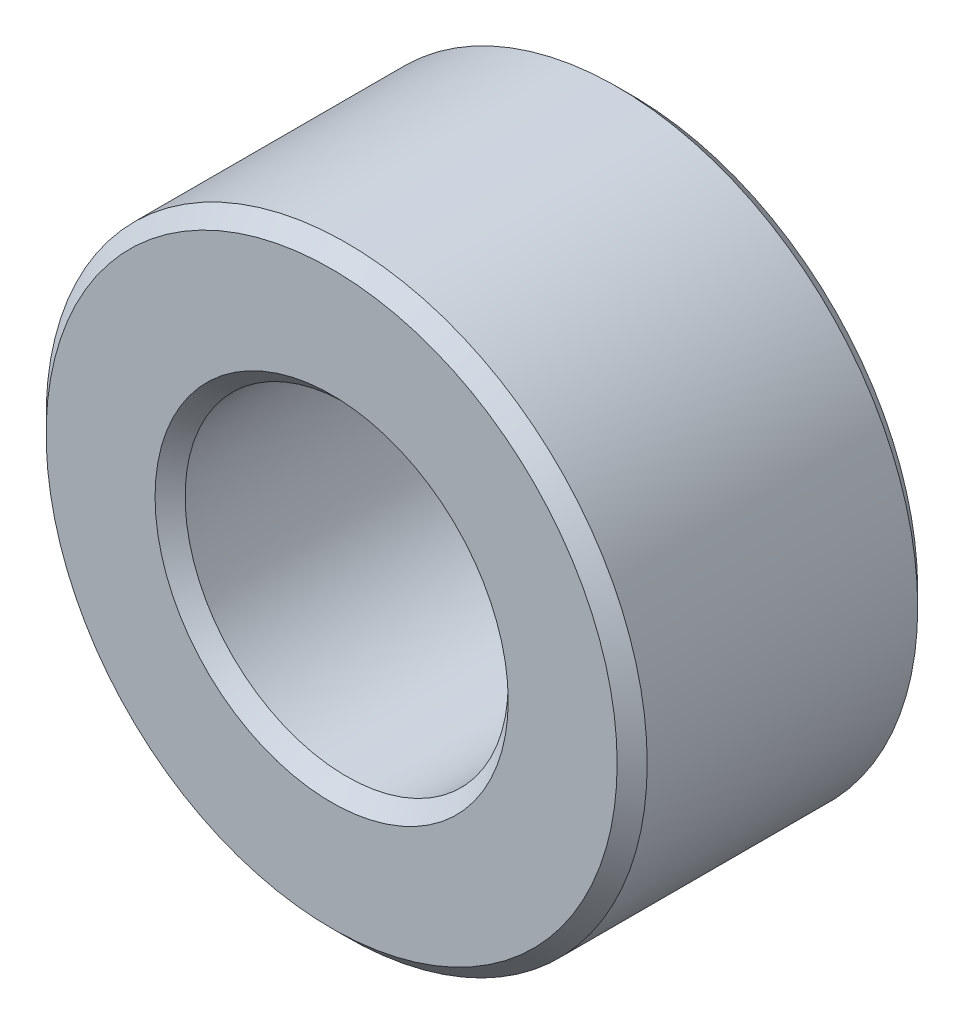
SolidWorks part; units mm, degrees
ref_plane "Front Plane" through (0, 0, 0) normal (0, 0, 1) x (1, 0, 0)
ref_plane "Top Plane" through (0, 0, 0) normal (0, 1, 0) x (1, 0, 0)
ref_plane "Right Plane" through (0, 0, 0) normal (1, 0, 0) x (0, 0, -1)
sketch "Sketch1" plane through (0, 0, 0) normal (0, 0, 1) x (1, 0, 0)
  circle A0 centre (0, 0) radius 4
  circle A1 centre (0, 0) radius 2.15
  dimension "D1" = 8
  dimension "D2" = 4.3
extrude "Boss-Extrude2" add sketch "Sketch1" along normal mid plane 4
chamfer "Chamfer3" distance 0.2 angle 45 4 edges at (4, 0, 2) (4, 0, -2) (2.15, 0, -2) (2.15, 0, 2)
